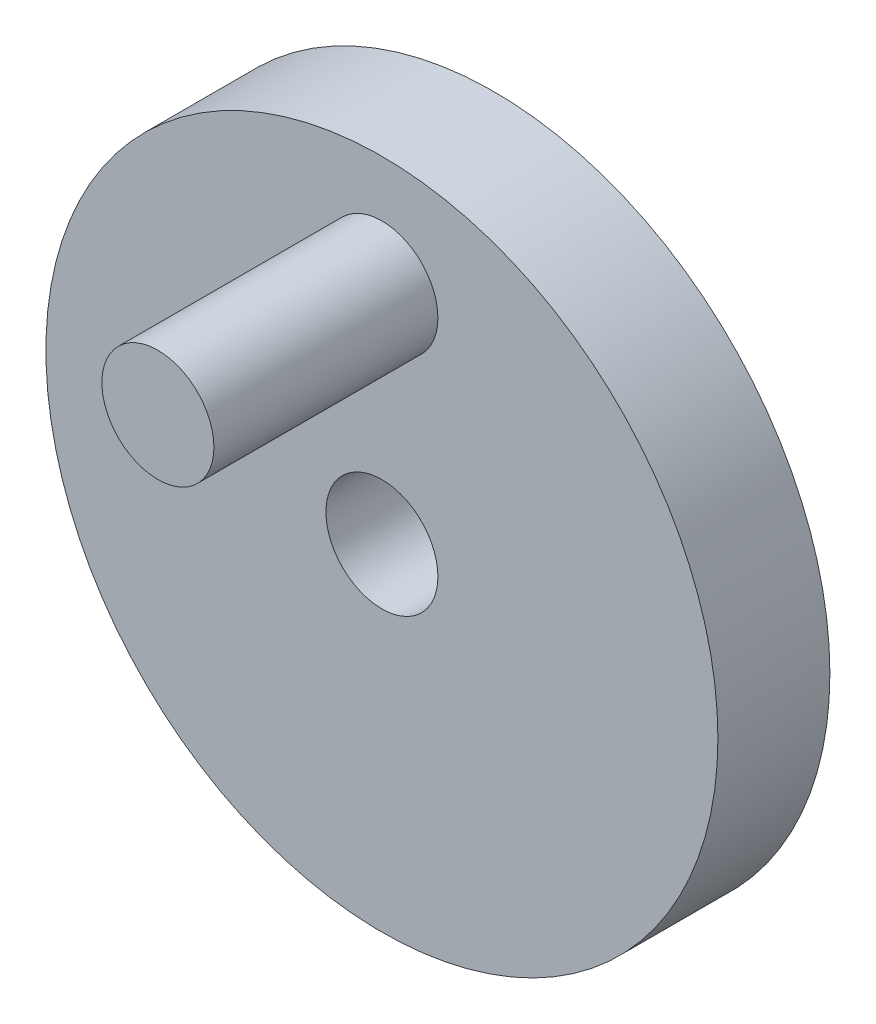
SolidWorks part; units mm, degrees
ref_plane "Front Plane" through (0, 0, 0) normal (0, 0, 1) x (1, 0, 0)
ref_plane "Top Plane" through (0, 0, 0) normal (0, 1, 0) x (1, 0, 0)
ref_plane "Right Plane" through (0, 0, 0) normal (1, 0, 0) x (0, 0, -1)
sketch "Sketch1" plane through (0, 0, 0) normal (0, 0, 1) x (1, 0, 0)
  circle A0 centre (0, 0) radius 30
  dimension "D1" = 60
extrude "Boss-Extrude1" add sketch "Sketch1" along normal blind 10
sketch "Sketch2" plane through (0, 0, 10) normal (0, 0, 1) x (1, 0, 0)
  circle A0 centre (0, 0) radius 5
  circle A1 centre (0, 0) radius 30 construction
  dimension "D1" = 10
extrude "Cut-Extrude1" cut sketch "Sketch2" against normal blind 10
sketch "Sketch3" plane through (0, 0, 10) normal (0, 0, 1) x (1, 0, 0)
  line L0 (0, 0) -> (0, 33.3439) construction
  circle A0 centre (0, 20) radius 5
  circle A1 centre (0, 0) radius 30 construction
  dimension "D1" = 10
  dimension "D2" = 20
extrude "Boss-Extrude2" add sketch "Sketch3" along normal blind 20
